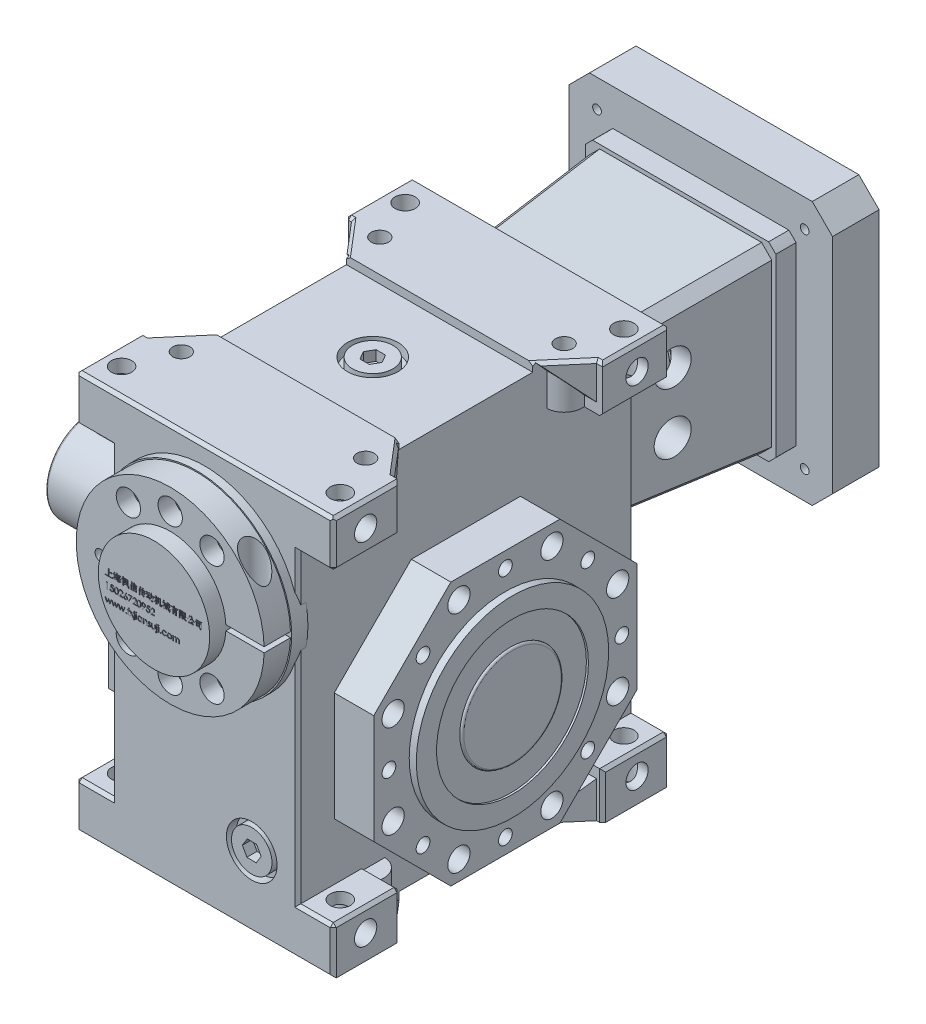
SolidWorks part; units mm, degrees
ref_plane "前视基准面" through (0, 0, 0) normal (0, 0, 1) x (1, 0, 0)
ref_plane "上视基准面" through (0, 0, 0) normal (0, 1, 0) x (1, 0, 0)
ref_plane "右视基准面" through (0, 0, 0) normal (1, 0, 0) x (0, 0, -1)
imported_body "JDLB063-CR箱体-1-solid1"
imported_body "JDLB063-CR箱体-1-solid2"
imported_body "JDLB063-ASR实心轴Φ45-1-solid1"
imported_body "JDLB063-ST94输入法兰-1-solid1"
imported_body "ST130-110-145-M8伺服法兰接口-1-solid1"
imported_body "联轴器BD56-60-20-22锁紧-2-solid1"
imported_body "联轴器BD56-60-20-22锁紧-2-solid2"
imported_body "联轴器BD56-60-20-22锁紧-2-solid3"
imported_body "联轴器BD56-60-20-22锁紧-2-solid4"
imported_body "联轴器BD56-60-20-22锁紧-2-solid5"
imported_body "联轴器BD56-60-20-22锁紧-2-solid6"
imported_body "联轴器BD56-60-20-22锁紧-2-solid7"
imported_body "联轴器BD56-60-20-22锁紧-2-solid8"
imported_body "联轴器BD56-60-20-22锁紧-2-solid9"
imported_body "联轴器BD56-60-20-22锁紧-2-solid10"
imported_body "联轴器BD56-60-20-22锁紧-2-solid11"
sketch "草图2" plane through (-47, 0, 0) normal (-1, 0, 0) x (0, 0, 1)
  line L1 (-29.734, 100.7021) -> (24.3788, 100.7021)
  line L2 (-29.734, 100.7021) -> (-29.734, 86.4539)
  line L3 (-29.734, 86.4539) -> (24.3788, 86.4539)
  line L4 (24.3788, 100.7021) -> (24.3788, 86.4539)
extrude "切除-拉伸1" cut sketch "草图2" against normal up to surface (1 mm away)
sketch "草图3" plane through (47, 0, 0) normal (1, 0, 0) x (0, 0, -1)
  line L9 (-31.2864, 101.3338) -> (34.827, 101.3338)
  line L10 (-31.2864, 101.3338) -> (-31.2864, 84.0868)
  line L11 (-31.2864, 84.0868) -> (34.827, 84.0868)
  line L12 (34.827, 101.3338) -> (34.827, 84.0868)
extrude "切除-拉伸2" cut sketch "草图3" against normal up to surface (1 mm away)
sketch "草图4" plane through (0, 0, 108) normal (0, 0, 1) x (1, 0, 0)
  text T0 "上海枫信传动机械有限公司  15026720952  www.fxjiansuji.com" font "Century Gothic" height in points 11
extrude "凸台-拉伸1" add sketch "草图4" along normal blind 0.2
